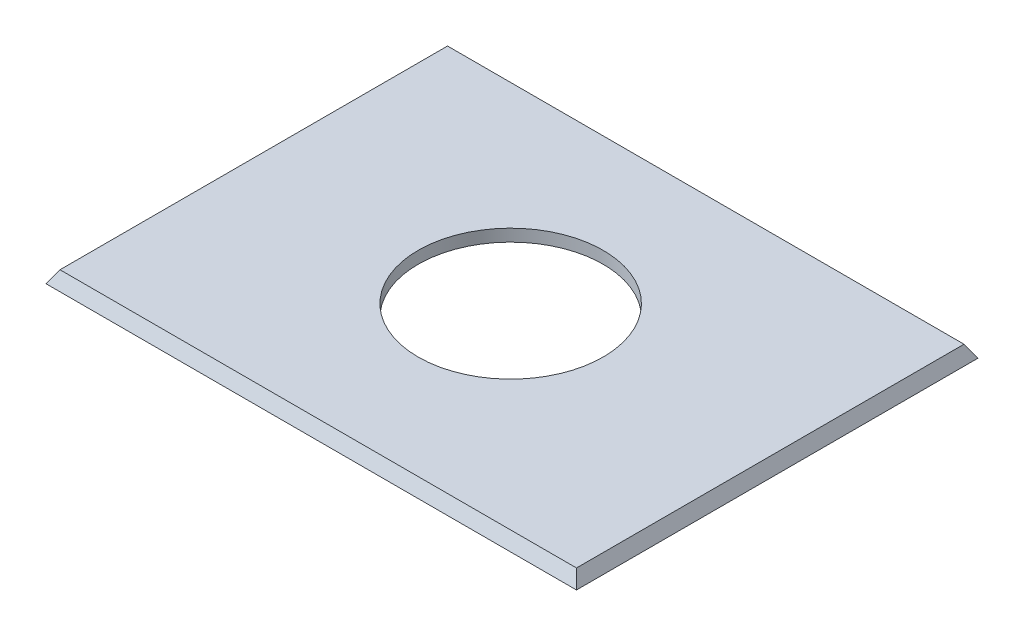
SolidWorks part; units mm, degrees
ref_plane "Front Plane" through (0, 0, 0) normal (0, 0, 1) x (1, 0, 0)
ref_plane "Top Plane" through (0, 0, 0) normal (0, 1, 0) x (1, 0, 0)
ref_plane "Right Plane" through (0, 0, 0) normal (1, 0, 0) x (0, 0, -1)
sketch "Sketch1" plane through (0, 0, 0) normal (0, 1, 0) x (1, 0, 0)
  line L1 (0, 0) -> (111.3575, 0)
  line L2 (0, 0) -> (0, 84.2861)
  line L3 (0, 84.2861) -> (111.3575, 84.2861)
  line L4 (111.3575, 0) -> (111.3575, 84.2861)
extrude "Extrude1" add sketch "Sketch1" along normal blind 2.54 draft 30
sketch "Sketch2" plane through (0, 2.54, 0) normal (0, 1, 0) x (-1, 0, 0)
  circle A0 centre (-54.9361, -42.6072) radius 19.4132
extrude "Cut-Extrude1" cut sketch "Sketch2" against normal through all
